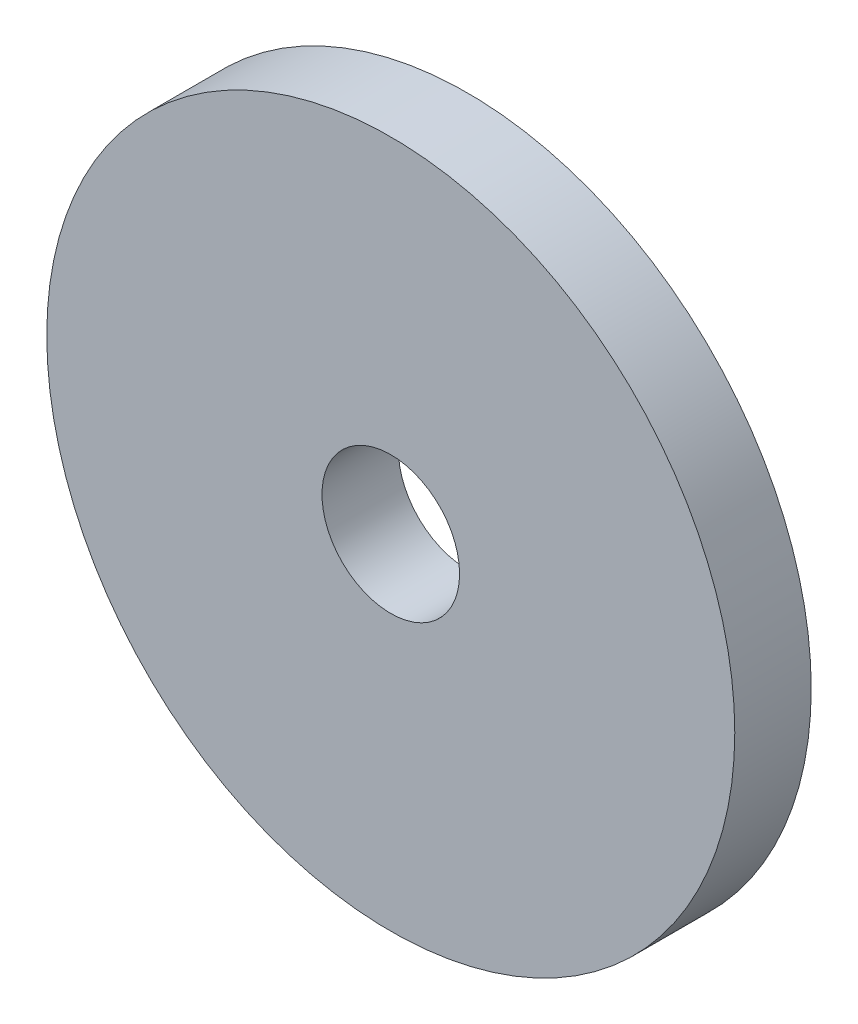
SolidWorks part; units mm, degrees
ref_plane "Face" through (0, 0, 0) normal (0, 0, 1) x (1, 0, 0)
ref_plane "Dessus" through (0, 0, 0) normal (0, 1, 0) x (1, 0, 0)
ref_plane "Droite" through (0, 0, 0) normal (1, 0, 0) x (0, 0, -1)
sketch "Esquisse1" plane through (0, 0, 0) normal (0, 0, 1) x (1, 0, 0)
  circle A0 centre (0, 0) radius 45
  circle A1 centre (0, 0) radius 9
  dimension "D1" = 90
  dimension "D2" = 18
extrude "Base-Extrusion" add sketch "Esquisse1" along normal blind 10
